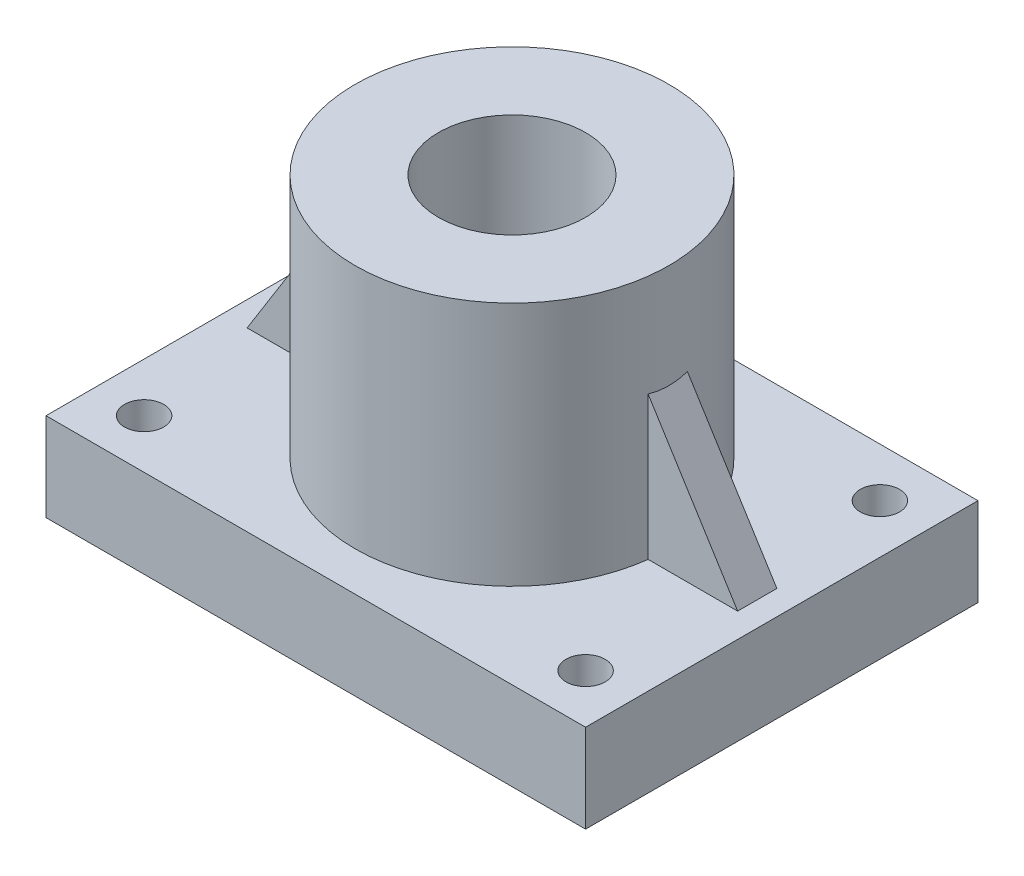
SolidWorks part; units mm, degrees
ref_plane "前视基准面" through (0, 0, 0) normal (0, 0, 1) x (1, 0, 0)
ref_plane "上视基准面" through (0, 0, 0) normal (0, 1, 0) x (1, 0, 0)
ref_plane "右视基准面" through (0, 0, 0) normal (1, 0, 0) x (0, 0, -1)
other "Configuration Table"
sketch "草图1" plane through (0, 0, 0) normal (0, 1, 0) x (1, 0, 0)
  line L1 (-55, -40) -> (55, -40)
  line L2 (-55, -40) -> (-55, 40)
  line L3 (-55, 40) -> (55, 40)
  line L4 (55, -40) -> (55, 40)
  line L5 (-55, -40) -> (55, 40) construction
  line L6 (-55, 40) -> (55, -40) construction
  point P0 (0, 0)
extrude "凸台-拉伸1" add sketch "草图1" along normal blind 18
sketch "草图2" plane through (0, 18, 0) normal (0, 1, 0) x (1, 0, 0)
  circle A0 centre (0, 0) radius 32
extrude "凸台-拉伸2" add sketch "草图2" along normal blind 50
sketch "草图3" plane through (0, 0, 0) normal (0, 1, 0) x (1, 0, 0)
  circle A0 centre (0, 0) radius 15
extrude "切除-拉伸1" cut sketch "草图3" along normal blind 75
sketch "草图4" plane through (0, 0, 0) normal (0, 0, 1) x (1, 0, 0)
  line L0 (25, 18) -> (50, 18)
  line L1 (-55, 18) -> (55, 18) construction
  line L2 (50, 18) -> (25, 58)
  line L3 (25, 58) -> (25, 18)
extrude "凸台-拉伸3" add sketch "草图4" against normal mid plane 8
sketch "草图5" plane through (0, 0, 0) normal (0, 0, 1) x (1, 0, 0)
  line L0 (-25, 18) -> (-50, 18)
  line L1 (-55, 18) -> (55, 18) construction
  line L2 (-50, 18) -> (-25, 58)
  line L3 (-25, 58) -> (-25, 18)
extrude "凸台-拉伸4" add sketch "草图5" against normal mid plane 8
sketch "草图6" plane through (0, 0, 0) normal (0, 1, 0) x (1, 0, 0)
  circle A0 centre (0, 0) radius 15
sketch "草图7" plane through (0, 0, 0) normal (0, 1, 0) x (1, 0, 0)
  circle A0 centre (45, 30) radius 4
extrude "切除-拉伸3" cut sketch "草图7" along normal blind 25
sketch "草图8" plane through (0, 0, 0) normal (0, 1, 0) x (1, 0, 0)
  circle A0 centre (-45, 30) radius 4
extrude "切除-拉伸4" cut sketch "草图8" along normal blind 25
sketch "草图9" plane through (0, 0, 0) normal (0, 1, 0) x (1, 0, 0)
  circle A0 centre (45, -30) radius 4
extrude "切除-拉伸5" cut sketch "草图9" along normal blind 25
sketch "草图10" plane through (0, 0, 0) normal (0, 1, 0) x (1, 0, 0)
  circle A0 centre (-45, -30) radius 4
extrude "切除-拉伸6" cut sketch "草图10" along normal blind 25
